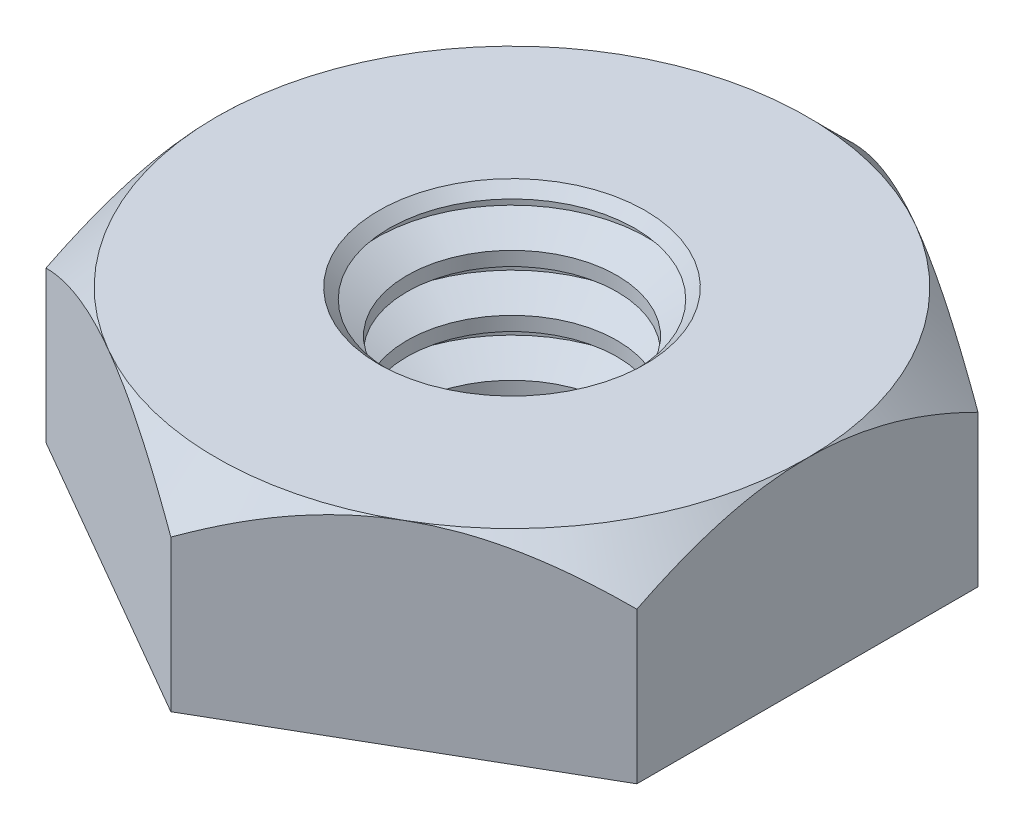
SolidWorks part; units mm, degrees
ref_plane "Front" through (0, 0, 0) normal (0, 0, 1) x (1, 0, 0)
ref_plane "Top" through (0, 0, 0) normal (0, 1, 0) x (1, 0, 0)
ref_plane "Right" through (0, 0, 0) normal (1, 0, 0) x (0, 0, -1)
sketch "Sketch1" plane through (0, 0, 0) normal (0, 1, 0) x (1, 0, 0)
  line L1 (0, 2.7496) -> (-2.3813, 1.3748)
  line L2 (-2.3813, 1.3748) -> (-2.3813, -1.3748)
  line L3 (-2.3813, -1.3748) -> (0, -2.7496)
  line L4 (0, -2.7496) -> (2.3812, -1.3748)
  line L5 (2.3812, -1.3748) -> (2.3812, 1.3748)
  line L6 (2.3812, 1.3748) -> (0, 2.7496)
  circle A0 centre (0, 0) radius 2.3813 construction
  dimension "Hex Flats" = 4.7625
extrude "Extrude1" add sketch "Sketch1" along normal blind 1.5875
sketch "Sketch3" plane through (0, 0, 0) normal (1, 0, 0) x (0, 0, -1)
  line L0 (2.3812, 1.5875) -> (2.7496, 1.2191)
  line L1 (1.3748, 1.5875) -> (2.7496, 1.5875) construction
  line L2 (2.7496, 1.5875) -> (2.7496, 0) construction
  line L3 (2.7496, 1.2191) -> (2.7496, 1.5875)
  line L4 (2.7496, 1.5875) -> (2.3812, 1.5875)
  line L5 (0, 0.542) -> (0, -0.542) construction
  dimension "D1" = 45
  dimension "D2" = 4.7625
revolve "Cut-Revolve2" cut sketch "Sketch3" angle 360 about L5
sketch "Sketch2" plane through (0, 0, 0) normal (0, 0, 1) x (1, 0, 0)
  line L0 (0, 1.6636) -> (0, -0.3796) construction
  line L1 (0, 1.5875) -> (0.8467, 1.5875)
  line L3 (0, 1.5875) -> (2.3812, 1.5875) construction
  line L4 (0, 1.1339) -> (0.8467, 1.1339)
  line L5 (0.8467, 1.5875) -> (1.0922, 1.4458)
  line L6 (1.0922, 1.4458) -> (1.0922, 1.3891)
  line L7 (1.0922, 1.3891) -> (0.8467, 1.2473)
  line L9 (0.8467, 1.1339) -> (0.8467, 1.2473)
  line L10 (0, 1.1339) -> (0, 1.5875)
  line L11 (0.8467, 1.5875) -> (0.8467, 1.2473) construction
  line L12 (1.0922, 1.4174) -> (0.8467, 1.4174) construction
  dimension "D1" = 60
  dimension "D2" = 0.1134
  dimension "D5" = 0.0567
  dimension "Pitch" = 0.4536
  dimension "Major Dia." = 2.1844
revolve "Cut-Revolve1" cut sketch "Sketch2" angle 360 about L0
pattern_linear "LPattern2" count 4 spacing 0.4536 along (0, -1, 0)
chamfer "Chamfer1" distance 0.2268 angle 45
equation "\"D5@Sketch2\"=\"Pitch@Sketch2\"/8"
equation "\"D2@Sketch2\"=\"Pitch@Sketch2\"/4"
equation "\"D3@LPattern2\"=\"Pitch@Sketch2\""
equation "\"D1@LPattern2\"=\"Height@Extrude1\"/\"Pitch@Sketch2\"+.5"
equation "\"D2@Sketch3\"=\"Hex Flats@Sketch1\""
equation "\"D1@Chamfer1\"=\"Pitch@Sketch2\"/2"
